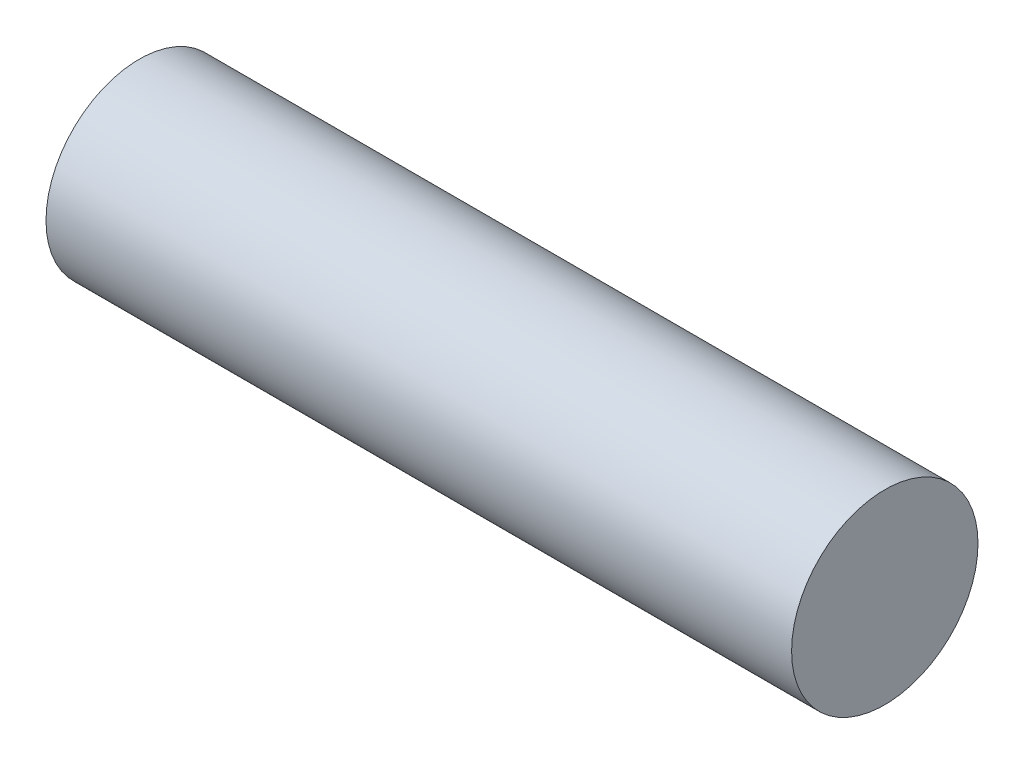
SolidWorks part; units mm, degrees
ref_plane "Front Plane" through (0, 0, 0) normal (1, 0, 0) x (0, 1, 0)
ref_plane "Top Plane" through (0, 0, 0) normal (0, 0, 1) x (0, 1, 0)
ref_plane "Right Plane" through (0, 0, 0) normal (0, 1, 0) x (-1, 0, 0)
sketch "Sketch1" plane through (0, 0, 0) normal (1, 0, 0) x (0, 1, 0)
  circle A0 centre (0, 0) radius 3.175
  dimension "D1" = 6.35
extrude "Boss-Extrude1" add sketch "Sketch1" along normal blind 25.4 contours A0
